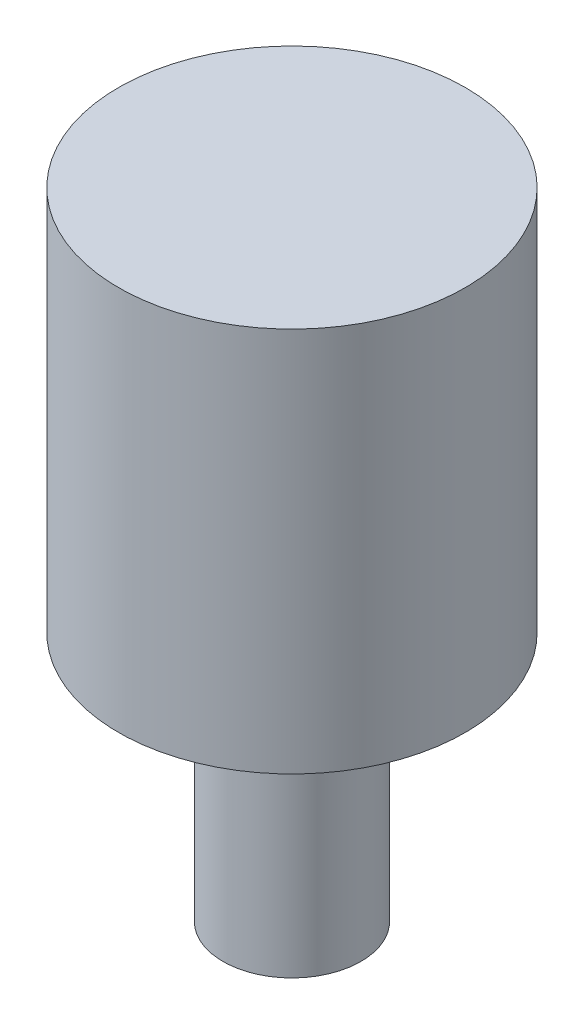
SolidWorks part; units mm, degrees
ref_plane "Front Plane" through (0, 0, 0) normal (0, 0, 1) x (1, 0, 0)
ref_plane "Top Plane" through (0, 0, 0) normal (0, 1, 0) x (1, 0, 0)
ref_plane "Right Plane" through (0, 0, 0) normal (1, 0, 0) x (0, 0, -1)
sketch "Sketch1" plane through (0, 0, 0) normal (0, 0, 1) x (1, 0, 0)
  line L0 (0, 0) -> (0, 13.0969) construction
  line L1 (0, 13.0969) -> (3.5719, 13.0969)
  line L2 (3.5719, 13.0969) -> (3.5719, 5.1594)
  line L3 (3.5719, 5.1594) -> (1.4224, 5.1594)
  line L4 (1.4224, 5.1594) -> (1.4224, 0)
  line L5 (1.4224, 0) -> (0, 0)
  line L6 (0, 0) -> (0, 13.0969)
  dimension "D1" = 7.1437
  dimension "D2" = 7.9375
  dimension "D3" = 5.1594
  dimension "D4" = 2.8448
revolve "Revolve1" add sketch "Sketch1" angle 360 about L0
